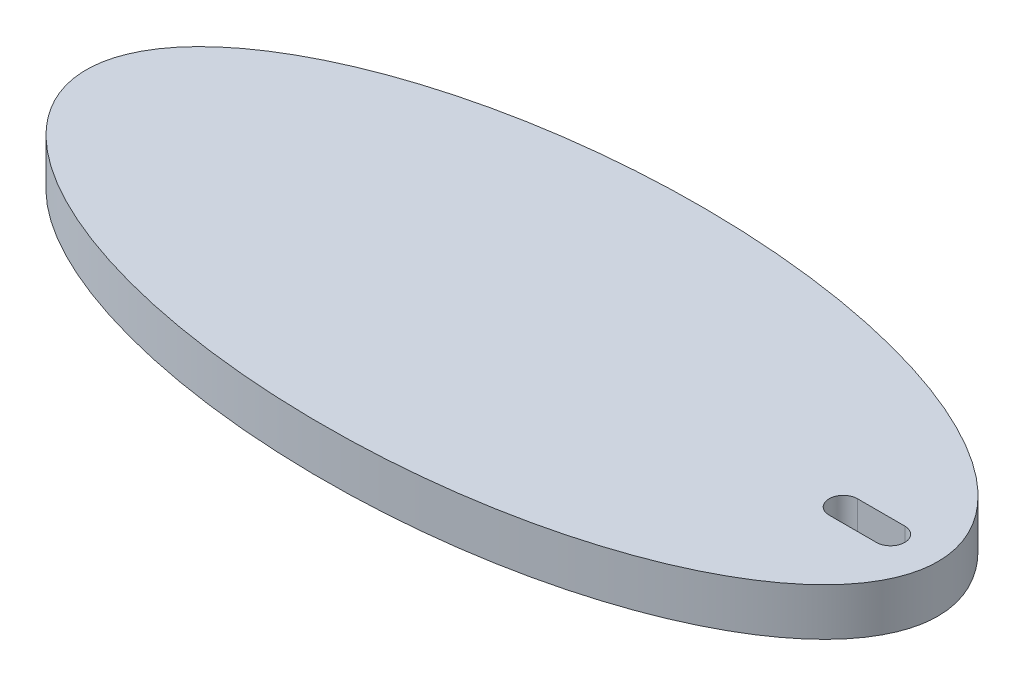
SolidWorks part; units mm, degrees
ref_plane "Front Plane" through (0, 0, 0) normal (0, 0, 1) x (1, 0, 0)
ref_plane "Top Plane" through (0, 0, 0) normal (0, 1, 0) x (1, 0, 0)
ref_plane "Right Plane" through (0, 0, 0) normal (1, 0, 0) x (0, 0, -1)
sketch "Sketch1" plane through (0, 0, 0) normal (0, 1, 0) x (1, 0, 0)
  ellipse E0 centre (0, 0) end of major axis (45, 0) minor radius 20
  dimension "D1" = 90
  dimension "D2" = 20
extrude "Extrude1" add sketch "Sketch1" along normal blind 5
sketch "Sketch2" plane through (0, 5, 0) normal (0, 1, 0) x (-1, 0, 0)
  line L0 (-35, -1.5) -> (-40, -1.5)
  line L1 (-40, 1.5) -> (-35, 1.5)
  line L2 (-40, 0) -> (-45, 0) construction
  arc A0 (-40, -1.5) -> (-40, 1.5) centre (-40, 0) cw
  arc A1 (-35, 1.5) -> (-35, -1.5) centre (-35, 0) cw
  ellipse E1 centre (0, 0) end of major axis (-45, 0) minor radius 20 construction
  dimension "D2" = 1.5
  dimension "D1" = 5
  dimension "D3" = 5
extrude "Cut-Extrude1" cut sketch "Sketch2" against normal blind 5
